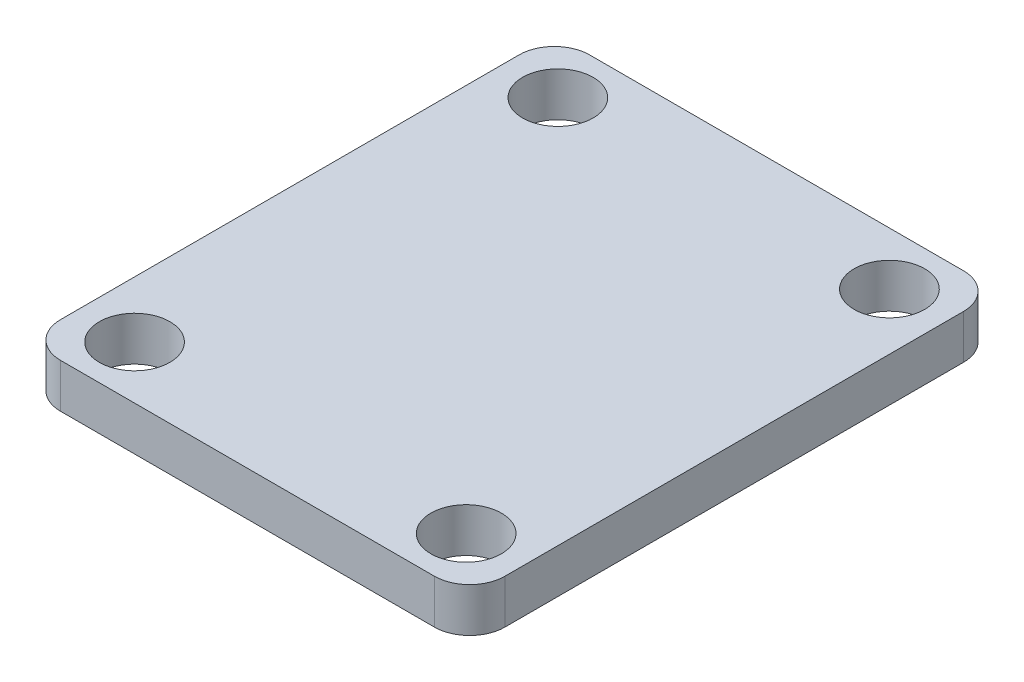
SolidWorks part; units mm, degrees
ref_plane "Front Plane" through (0, 0, 0) normal (0, 0, 1) x (1, 0, 0)
ref_plane "Top Plane" through (0, 0, 0) normal (0, 1, 0) x (1, 0, 0)
ref_plane "Right Plane" through (0, 0, 0) normal (1, 0, 0) x (0, 0, -1)
sketch "Sketch3" plane through (0, 0, 0) normal (0, 1, 0) x (1, 0, 0)
  line L1 (16.002, -19.05) -> (-16.002, -19.05)
  line L2 (16.002, -19.05) -> (16.002, 19.05)
  line L3 (16.002, 19.05) -> (-16.002, 19.05)
  line L4 (-16.002, -19.05) -> (-16.002, 19.05)
  line L5 (16.002, -19.05) -> (-16.002, 19.05) construction
  line L6 (16.002, 19.05) -> (-16.002, -19.05) construction
  point P0 (0, 0)
  dimension "D1" = 32.004
  dimension "D2" = 38.1
extrude "Boss-Extrude1" add sketch "Sketch3" against normal blind 3.175
sketch "Sketch4" plane through (0, 0, 0) normal (0, 1, 0) x (1, 0, 0)
  line L1 (11.938, 15.24) -> (-11.938, 15.24) construction
  line L2 (11.938, 15.24) -> (11.938, -15.24) construction
  line L3 (11.938, -15.24) -> (-11.938, -15.24) construction
  line L4 (-11.938, 15.24) -> (-11.938, -15.24) construction
  line L5 (11.938, 15.24) -> (-11.938, -15.24) construction
  line L6 (11.938, -15.24) -> (-11.938, 15.24) construction
  circle A0 centre (11.938, 15.24) radius 2.54
  circle A1 centre (-11.938, 15.24) radius 2.54
  circle A2 centre (-11.938, -15.24) radius 2.54
  circle A3 centre (11.938, -15.24) radius 2.54
  point P0 (0, 0)
  dimension "D3" = 5.08
  dimension "D1" = 30.48
  dimension "D2" = 23.876
extrude "Cut-Extrude1" cut sketch "Sketch4" against normal through all
fillet "Fillet1" radius 2.54 4 edges at (-16.002, -1.5875, 19.05) (-16.002, -1.5875, -19.05) (16.002, -1.5875, -19.05) (16.002, -1.5875, 19.05)
sketch "Sketch5" plane through (0, 0, 0) normal (0, 1, 0) x (1, 0, 0)
  line L10 (16.0782, -16.51) -> (16.0782, 16.51)
  line L11 (-13.462, -19.1262) -> (13.462, -19.1262)
  line L12 (-16.0782, 16.51) -> (-16.0782, -16.51)
  line L13 (13.462, 19.1262) -> (-13.462, 19.1262)
  line L14 (16.0782, -16.51) -> (16.0782, 16.51)
  line L15 (-13.462, -19.1262) -> (13.462, -19.1262)
  line L16 (-16.0782, 16.51) -> (-16.0782, -16.51)
  line L17 (13.462, 19.1262) -> (-13.462, 19.1262)
  circle A7 centre (-11.938, 15.24) radius 2.4638
  circle A8 centre (-11.938, 15.24) radius 2.4638
  arc A9 (16.0782, 16.51) -> (13.462, 19.1262) centre (13.462, 16.51) ccw
  arc A10 (13.462, -19.1262) -> (16.0782, -16.51) centre (13.462, -16.51) ccw
  arc A11 (-16.0782, -16.51) -> (-13.462, -19.1262) centre (-13.462, -16.51) ccw
  arc A12 (-13.462, 19.1262) -> (-16.0782, 16.51) centre (-13.462, 16.51) ccw
  arc A13 (16.0782, 16.51) -> (13.462, 19.1262) centre (13.462, 16.51) ccw
  arc A14 (13.462, -19.1262) -> (16.0782, -16.51) centre (13.462, -16.51) ccw
  arc A15 (-16.0782, -16.51) -> (-13.462, -19.1262) centre (-13.462, -16.51) ccw
  arc A16 (-13.462, 19.1262) -> (-16.0782, 16.51) centre (-13.462, 16.51) ccw
  circle A18 centre (11.938, 15.24) radius 2.4638
  circle A19 centre (11.938, 15.24) radius 2.4638
  circle A21 centre (-11.938, -15.24) radius 2.4638
  circle A22 centre (-11.938, -15.24) radius 2.4638
  circle A24 centre (11.938, -15.24) radius 2.4638
  circle A25 centre (11.938, -15.24) radius 2.4638
  dimension "D1" = 0.0762
  dimension "D2" = 0.0762
  dimension "D3" = 0.0762
  dimension "D4" = 0.0762
  dimension "D5" = 0.0762
